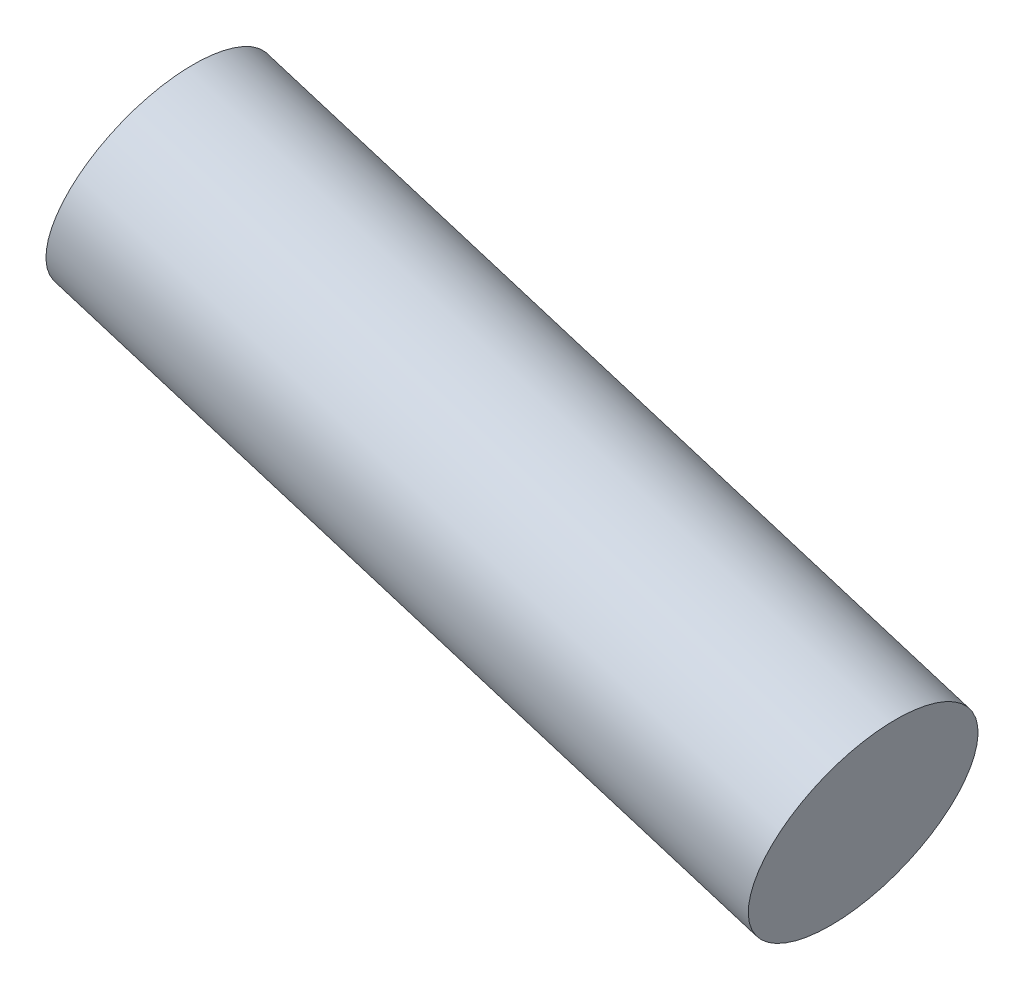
SolidWorks part; units mm, degrees
ref_plane "Ebene vorne" through (0, 0, 0) normal (0, 0, 1) x (1, 0, 0)
ref_plane "Ebene oben" through (0, 0, 0) normal (0, 1, 0) x (1, 0, 0)
ref_plane "Ebene rechts" through (0, 0, 0) normal (1, 0, 0) x (0, 0, -1)
sketch "Skizze1" plane through (0, 0, 0) normal (0, 0, 1) x (1, 0, 0)
  line L0 (769.0209, -220.9794) -> (764.6087, -235.3158)
  line L1 (764.6087, -235.3158) -> (860.1848, -264.7303)
  line L2 (860.1848, -264.7303) -> (864.597, -250.3939)
  line L3 (864.597, -250.3939) -> (769.0209, -220.9794)
  line L4 (0, 0) -> (764.6087, -235.3158) construction
  dimension "D1" = 15
  dimension "D2" = 100
  dimension "D3" = 800
revolve "Rotation1" add sketch "Skizze1" angle 360 about L1
equation "\"LÄNGE\"=0"
equation "\"BREITE\"=0"
equation "\"HÖHE\"=0"
equation "\"DURCHMESSER\"=0"
equation "\"Stückzahl\"= 1"
